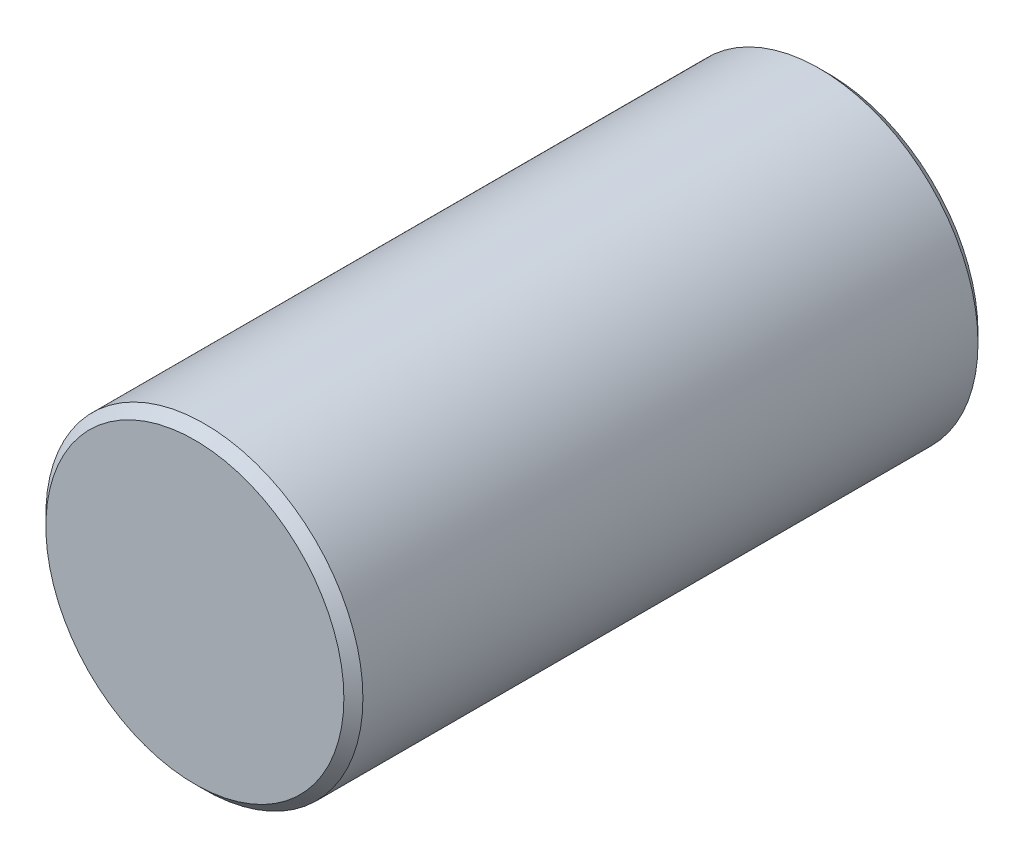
SolidWorks part; units mm, degrees
ref_plane "Front/Back" through (0, 0, 0) normal (0, 0, 1) x (1, 0, 0)
ref_plane "Top/Bottom" through (0, 0, 0) normal (0, 1, 0) x (1, 0, 0)
ref_plane "Right/Left" through (0, 0, 0) normal (1, 0, 0) x (0, 0, -1)
sketch "Sketch1" plane through (0, 0, 0) normal (0, 0, 1) x (1, 0, 0)
  circle A0 centre (0, 0) radius 12.7
  dimension "D1" = 25.4
extrude "Extrude1" add sketch "Sketch1" along normal mid plane 50.8
chamfer "Chamfer1" distance 0.762 angle 45 1 edges at (12.7, 0, 25.4)
chamfer "Chamfer2" distance 0.762 angle 45 1 edges at (12.7, 0, -25.4)
